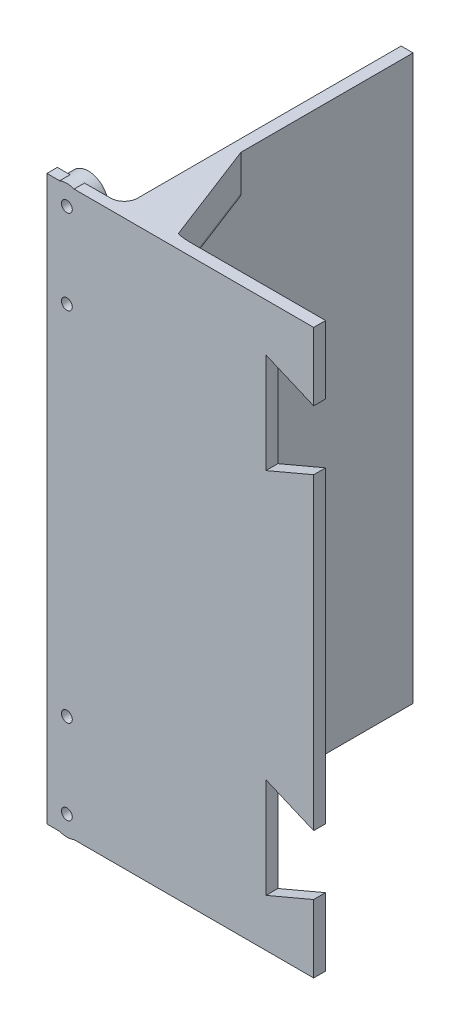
SolidWorks part; units mm, degrees
ref_plane "Front Plane" through (0, 0, 0) normal (0, 0, 1) x (1, 0, 0)
ref_plane "Top Plane" through (0, 0, 0) normal (0, 1, 0) x (1, 0, 0)
ref_plane "Right Plane" through (0, 0, 0) normal (1, 0, 0) x (0, 0, -1)
sketch "Sketch1" plane through (0, 0, 0) normal (0, 1, 0) x (1, 0, 0)
  line L0 (21.9498, 0) -> (-7.0824, 0)
  line L1 (-18.0933, 11.0109) -> (-18.0933, 58.6771)
  line L2 (-18.0933, 58.6771) -> (-20.6333, 58.6771)
  line L3 (-34.8594, -0.3168) -> (-23.5392, -0.3168)
  line L4 (-34.8594, -2.54) -> (21.9498, -2.54)
  line L5 (21.9498, -2.54) -> (21.9498, 0)
  line L6 (-20.6333, 2.5891) -> (-20.6333, 58.6771)
  line L7 (-34.8594, -0.3168) -> (-34.8594, -2.54)
  line L10 (50.982, 0) -> (-7.0824, 0) construction
  arc A0 (-7.0824, 0) -> (-18.0933, 11.0109) centre (-7.0824, 11.0109) cw
  arc A1 (-23.5392, -0.3168) -> (-20.6333, 2.5891) centre (-23.5392, 2.5891) ccw
  point P8 (-24.1502, -0.3168)
  point P11 (-32.2024, -2.54)
  point P12 (-35.4616, -2.54)
  point P13 (-20.6333, 11.0109)
  point P14 (-20.6333, 2.5891)
  point P16 (-18.0933, 58.6771)
  point P17 (10.0698, 0)
  point P24 (0, 0)
  point P27 (21.9498, 0)
  dimension "D1" = 2.54
extrude "Boss-Extrude1" add sketch "Sketch1" along normal up to surface and the other way up to surface
sketch "Sketch2" plane through (0, 0, 0) normal (0, 0, -1) x (-1, 0, 0)
  line L0 (-21.9498, 34.4563) -> (-11.7898, 38.769)
  line L1 (-21.9498, 48.929) -> (-21.9498, -71.071) construction
  line L2 (-11.7898, 38.769) -> (-11.7898, 17.4437)
  line L3 (-11.7898, 17.4437) -> (-21.9498, 21.7563)
  line L4 (-21.9498, 21.7563) -> (-21.9498, 34.4563)
  line L5 (-21.9498, -43.8983) -> (-11.7898, -39.5857)
  line L6 (-11.7898, -39.5857) -> (-11.7898, -60.911)
  line L7 (-11.7898, -60.911) -> (-21.9498, -56.5983)
  line L8 (-21.9498, -56.5983) -> (-21.9498, -43.8983)
  line L9 (-21.9498, 34.4563) -> (-21.9498, 38.769) construction
  line L10 (-21.9498, 38.769) -> (-11.7898, 38.769) construction
  line L11 (-21.9498, 21.7563) -> (-21.9498, 17.4437) construction
  line L12 (-21.9498, 17.4437) -> (-11.7898, 17.4437) construction
  line L13 (-21.9498, -43.8983) -> (-21.9498, -39.5857) construction
  line L14 (-21.9498, -39.5857) -> (-11.7898, -39.5857) construction
  line L15 (-21.9498, -56.5983) -> (-21.9498, -60.911) construction
  line L16 (-21.9498, -60.911) -> (-11.7898, -60.911) construction
  line L17 (-21.9498, 17.4437) -> (-21.9498, -39.5857) construction
  line L18 (7.0824, 48.929) -> (-21.9498, 48.929) construction
  point P12 (-21.9498, -11.071)
  point P15 (-21.9498, 42.5714)
  dimension "D1" = 10.16
  dimension "D2" = 67
  dimension "D3" = 12.7
  dimension "D4" = 10.16
extrude "Cut-Extrude1" cut sketch "Sketch2" against normal through all
sketch "Sketch3" plane through (0, 48.929, 0) normal (0, 1, 0) x (1, 0, 0)
  line L0 (-9.6224, 0) -> (-18.0933, 22.0218)
  line L1 (-18.0933, 58.6771) -> (-18.0933, 11.0109) construction
  line L2 (-7.0824, 22.0218) -> (50.982, 22.0218) construction
  line L3 (-9.6224, 0) -> (-18.0933, 0)
  line L4 (-18.0933, 0) -> (-18.0933, 22.0218)
  point P5 (-18.0933, 22.0218)
  point P8 (-18.0933, 22.0218)
  point P11 (-11.0965, 0)
  dimension "D1" = 2.54
extrude "Boss-Extrude2" add sketch "Sketch3" against normal up to surface (10.16 mm away)
sketch "Sketch4" plane through (0, -71.071, 0) normal (0, -1, 0) x (1, 0, 0)
  line L0 (-9.6224, 0) -> (-18.0933, -22.0218)
  line L1 (-18.0933, -58.6771) -> (-18.0933, -11.0109) construction
  line L2 (-9.7484, -0.3276) -> (-18.0933, -22.0218) construction
  line L4 (-9.6224, 0) -> (-18.0933, 0)
  line L5 (-18.0933, 0) -> (-18.0933, -22.0218)
  point P8 (-18.0933, -21.97)
extrude "Boss-Extrude3" add sketch "Sketch4" against normal up to surface (12.8628 mm away)
fillet "Fillet1" radius 2.54 2 edges at (-13.9208, -58.2082, -11.1747) (-13.9208, 38.769, -11.1747)
sketch "Sketch5" plane through (0, 0, 2.54) normal (0, 0, 1) x (1, 0, 0)
  line L0 (-34.5859, 46.465) -> (-34.5859, 25.465)
  line L1 (-26.6329, 25.465) -> (-26.6329, 46.465)
  arc A0 (-34.5859, 25.465) -> (-26.6329, 25.465) centre (-30.6094, 26.965) ccw construction
  arc A1 (-26.6329, 46.465) -> (-34.5859, 46.465) centre (-30.6094, 44.965) ccw construction
  arc A2 (-34.5859, 25.465) -> (-26.6329, 25.465) centre (-30.6094, 26.965) ccw
  arc A3 (-26.6329, 46.465) -> (-34.5859, 46.465) centre (-30.6094, 44.965) ccw
extrude "Boss-Extrude4" add sketch "Sketch5" against normal blind 4.572
sketch "Sketch6" plane through (0, 0, -2.032) normal (0, 0, -1) x (-1, 0, 0)
  arc A0 (29.4594, 26.965) -> (31.7594, 26.965) centre (30.6094, 26.965) ccw construction
  arc A1 (31.7594, 44.965) -> (29.4594, 44.965) centre (30.6094, 44.965) ccw construction
  arc A2 (29.4594, 26.965) -> (31.7594, 26.965) centre (30.6094, 26.965) ccw construction
  arc A3 (31.7594, 44.965) -> (29.4594, 44.965) centre (30.6094, 44.965) ccw construction
  circle A4 centre (30.6094, 44.965) radius 1.15
  circle A5 centre (30.6094, 26.965) radius 1.15
extrude "Cut-Extrude2" cut sketch "Sketch6" against normal through all
ref_plane "Plane1" through (0, -11.071, 0) normal (0, 1, 0) x (1, 0, 0)
mirror "Mirror1" about plane through (0, -11.071, 0) normal (0, 1, 0) of "Cut-Extrude2", "Boss-Extrude4"
